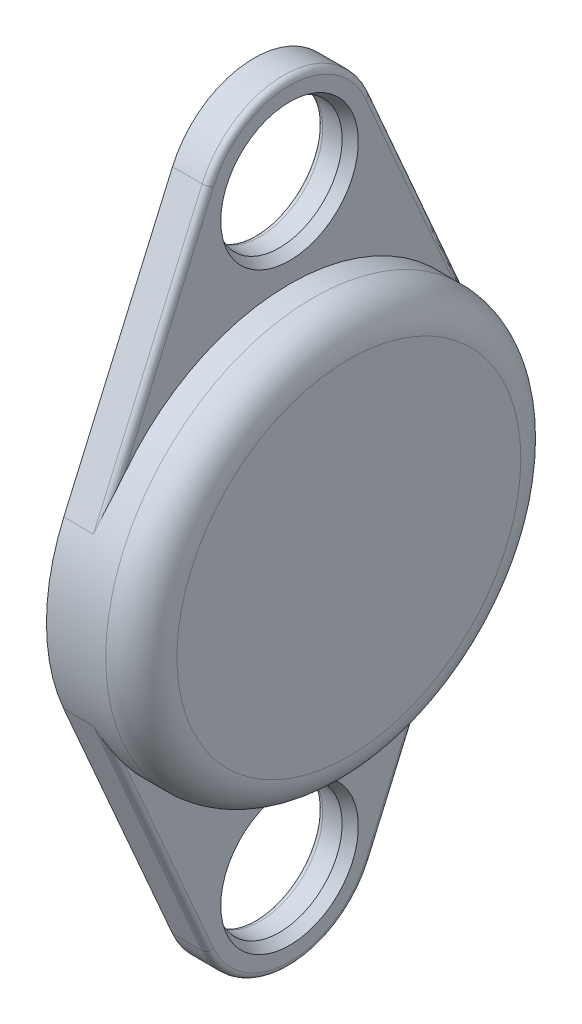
SolidWorks part; units mm, degrees
ref_plane "Plan de face" through (0, 0, 0) normal (0, 0, 1) x (1, 0, 0)
ref_plane "Plan de dessus" through (0, 0, 0) normal (0, 1, 0) x (1, 0, 0)
ref_plane "Plan de droite" through (0, 0, 0) normal (1, 0, 0) x (0, 0, -1)
sketch "Esquisse1" plane through (0, 0, 0) normal (0, 1, 0) x (1, 0, 0)
  line L0 (0, 0) -> (-11.9602, 0) construction
  line L1 (-5, 0) -> (0, 0)
  line L9 (0, 0) -> (0, 14.5)
  line L10 (-3, 17.5) -> (-5, 17.5)
  line L11 (-5, 17.5) -> (-5, 0)
  arc A0 (-3, 17.5) -> (0, 14.5) centre (-3, 14.5) cw
  dimension "D11" = 3
  dimension "D5" = 5
revolve "Révolution1" add sketch "Esquisse1" angle 360 about L0
sketch "Esquisse2" plane through (-5, 0, 0) normal (-1, 0, 0) x (0, 0, 1)
  line L0 (-6.8739, 28) -> (-16.039, 7)
  line L1 (6.8739, 28) -> (16.039, 7)
  line L2 (-16.039, -7) -> (-6.8739, -28)
  line L3 (16.039, -7) -> (6.8739, -28)
  arc A0 (6.8739, 28) -> (-6.8739, 28) centre (0, 25) ccw
  arc A1 (-6.8739, -28) -> (6.8739, -28) centre (0, -25) ccw
  arc A2 (16.039, -7) -> (16.039, 7) centre (0, 0) ccw
  circle A3 centre (0, 0) radius 17.5 construction
  arc A4 (-16.039, 7) -> (-16.039, -7) centre (0, 0) ccw
  circle A5 centre (0, 25) radius 5.3
  circle A6 centre (0, -25) radius 5.3
  dimension "D1" = 15
  dimension "D2" = 15
  dimension "D5" = 10.6
  dimension "D6" = 10.6
  dimension "D3" = 25
  dimension "D4" = 25
extrude "Extrusion1" add sketch "Esquisse2" along normal blind 3
fillet "Congé1" radius 0.5 6 edges at (-5, 32.5, 0) (-5, -32.5, 0)
chamfer "Chanfrein1" distance 0.5 angle 60 2 edges at (-5, 25, 5.3) (-5, -25, 5.3)
fillet "Congé2" radius 0.5 2 edges at (-8, 25, 5.3) (-8, -25, 5.3)
